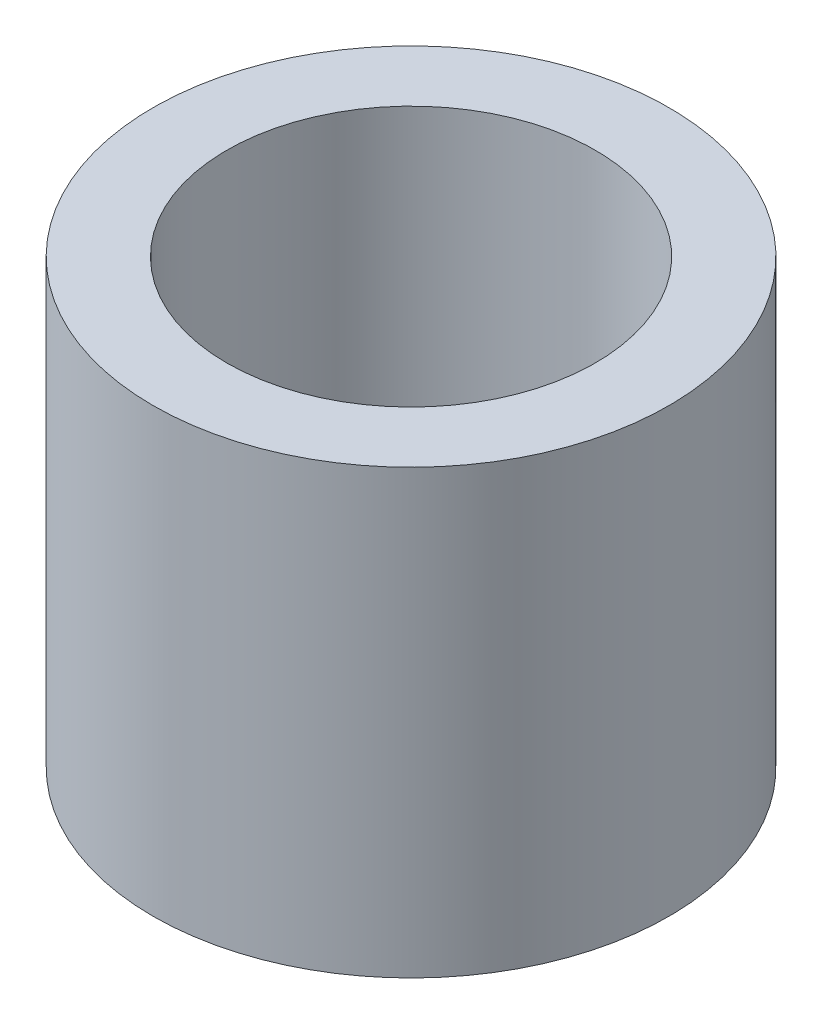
SolidWorks part; units mm, degrees
ref_plane "Plan de face" through (0, 0, 0) normal (0, 0, 1) x (1, 0, 0)
ref_plane "Plan de dessus" through (0, 0, 0) normal (0, 1, 0) x (1, 0, 0)
ref_plane "Plan de droite" through (0, 0, 0) normal (1, 0, 0) x (0, 0, -1)
sketch "Esquisse1" plane through (0, 0, 0) normal (0, 1, 0) x (1, 0, 0)
  circle A0 centre (0, 0) radius 3.5
  circle A1 centre (0, 0) radius 2.5
  dimension "D1" = 7
  dimension "D2" = 5
extrude "Extrusion1" add sketch "Esquisse1" along normal blind 6
